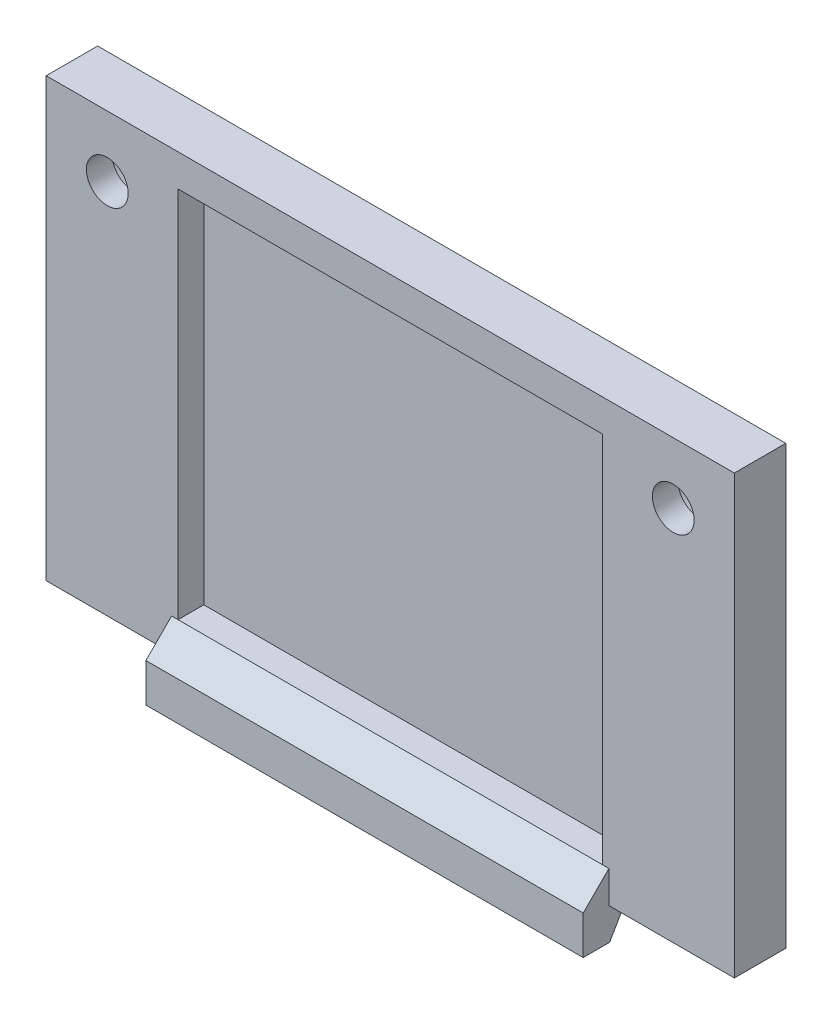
SolidWorks part; units mm, degrees
ref_plane "Planta" through (0, 0, 0) normal (0, 0, 1) x (1, 0, 0)
ref_plane "Perfil" through (0, 0, 0) normal (0, 1, 0) x (1, 0, 0)
ref_plane "Alzado" through (0, 0, 0) normal (1, 0, 0) x (0, 0, -1)
sketch "Croquis1" plane through (0, 0, 0) normal (0, 0, 1) x (1, 0, 0)
  line L1 (26.75, -17) -> (-26.75, -17)
  line L2 (26.75, -17) -> (26.75, 17)
  line L3 (26.75, 17) -> (-26.75, 17)
  line L4 (-26.75, -17) -> (-26.75, 17)
  line L5 (26.75, -17) -> (-26.75, 17) construction
  line L6 (26.75, 17) -> (-26.75, -17) construction
  circle A0 centre (-22, 12.25) radius 3.25
  circle A2 centre (22, 12.25) radius 3.25
  point P0 (0, 0)
  dimension "D3" = 44
  dimension "D4" = 6.5
  dimension "D1" = 4.75
  dimension "D2" = 34
  dimension "D5" = 4.75
  dimension "D6" = 4.75
  dimension "D7" = 53.5
extrude "Saliente-Extruir1" add sketch "Croquis1" along normal blind 2
sketch "Croquis3" plane through (0, 0, 2) normal (0, 0, 1) x (1, 0, 0)
  line L1 (-26.75, 17) -> (26.75, 17)
  line L2 (-26.75, 17) -> (-26.75, -17)
  line L3 (-26.75, -17) -> (26.75, -17)
  line L4 (26.75, 17) -> (26.75, -17)
  line L5 (-26.75, 17) -> (26.75, -17) construction
  line L6 (-26.75, -17) -> (26.75, 17) construction
  circle A0 centre (22, 12.25) radius 1.625
  circle A1 centre (-22, 12.25) radius 1.625
  point P6 (0, 0)
  dimension "D1" = 3.25
  dimension "D2" = 3.25
extrude "Saliente-Extruir2" add sketch "Croquis3" along normal blind 2
sketch "Croquis4" plane through (0, 0, 4) normal (0, 0, 1) x (1, 0, 0)
  line L0 (-26.75, -17) -> (26.75, -17) construction
  line L1 (-17, -19.5) -> (17, -19.5)
  line L2 (-17, -19.5) -> (-17, -14.5)
  line L3 (-17, -14.5) -> (17, -14.5)
  line L4 (17, -19.5) -> (17, -14.5)
  line L5 (-17, -19.5) -> (17, -14.5) construction
  line L6 (-17, -14.5) -> (17, -19.5) construction
  point P0 (0, -17)
  dimension "D1" = 2.5
  dimension "D2" = 34
extrude "Saliente-Extruir4" add sketch "Croquis4" along normal blind 2
chamfer "Chaflán1" distance 1.5 angle 60 1 edges at (0, -17, 4)
sketch "Croquis5" plane through (0, 0, 4) normal (0, 0, 1) x (1, 0, 0)
  line L1 (16.5, -14.5) -> (-16.5, -14.5)
  line L2 (16.5, -14.5) -> (16.5, 14.5)
  line L3 (16.5, 14.5) -> (-16.5, 14.5)
  line L4 (-16.5, -14.5) -> (-16.5, 14.5)
  line L5 (16.5, -14.5) -> (-16.5, 14.5) construction
  line L6 (16.5, 14.5) -> (-16.5, -14.5) construction
  point P0 (0, 0)
  dimension "D1" = 33
  dimension "D2" = 29
extrude "Cortar-Extruir1" cut sketch "Croquis5" against normal blind 2
chamfer "Chaflán2" distance 2 angle 45 1 edges at (0, -14.5, 6)
